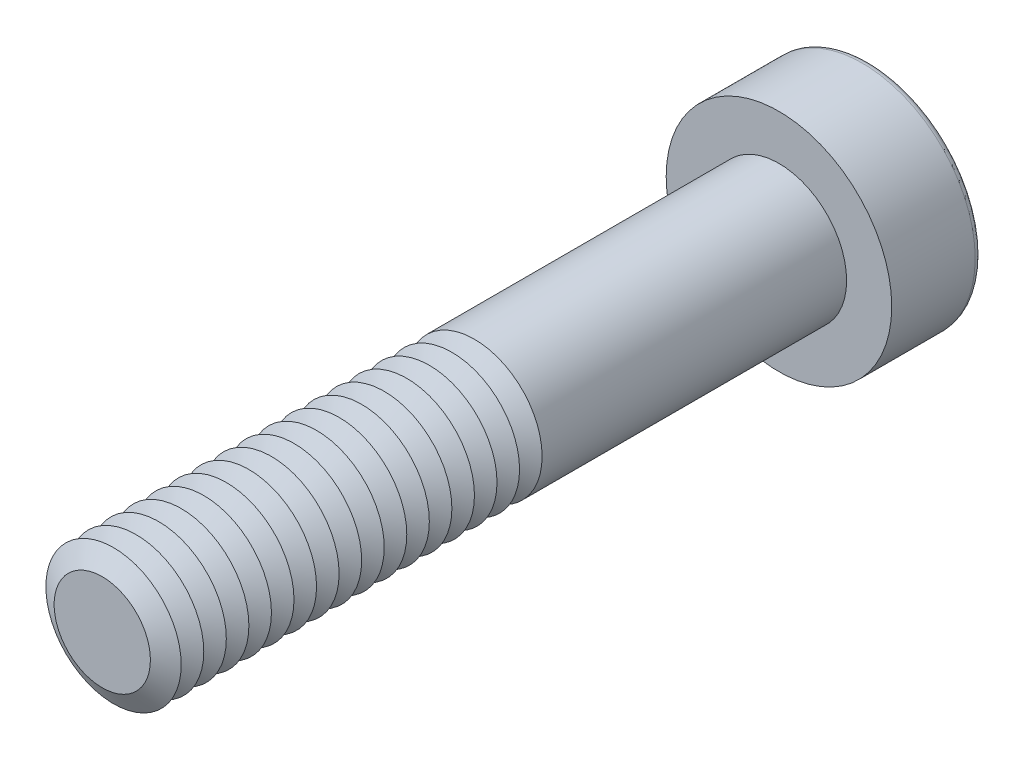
SolidWorks part; units mm, degrees
ref_plane "Front Plane" through (0, 0, 0) normal (0, 0, 1) x (1, 0, 0)
ref_plane "Top Plane" through (0, 0, 0) normal (0, 1, 0) x (1, 0, 0)
ref_plane "Right Plane" through (0, 0, 0) normal (1, 0, 0) x (0, 0, -1)
sketch "Sketch1" plane through (0, 0, 0) normal (0, 0, 1) x (1, 0, 0)
  circle A0 centre (0, 0) radius 3
  dimension "D1" = 6
extrude "Boss-Extrude1" add sketch "Sketch1" along normal blind 30
sketch "Sketch2" plane through (0, 0, 0) normal (0, 0, -1) x (-1, 0, 0)
  circle A0 centre (0, 0) radius 5
  dimension "D1" = 10
extrude "Boss-Extrude2" add sketch "Sketch2" along normal blind 4
sketch "Sketch3" plane through (0, 0, -4) normal (0, 0, -1) x (-1, 0, 0)
  line L1 (-1.1547, 2) -> (-2.3094, 0)
  line L2 (-2.3094, 0) -> (-1.1547, -2)
  line L3 (-1.1547, -2) -> (1.1547, -2)
  line L4 (1.1547, -2) -> (2.3094, 0)
  line L5 (2.3094, 0) -> (1.1547, 2)
  line L6 (1.1547, 2) -> (-1.1547, 2)
  circle A0 centre (0, 0) radius 2 construction
  dimension "D1" = 4
extrude "Cut-Extrude1" cut sketch "Sketch3" against normal blind 3
fillet "Fillet1" radius 0.3 1 edges at (-5, 0, -4)
sketch "Sketch4" plane through (0, 0, -1) normal (0, 0, -1) x (-1, 0, 0)
  line L0 (1.1547, -2) -> (2.3094, 0) construction
  circle A0 centre (0, 0) radius 2
extrude "Cut-Extrude2" cut sketch "Sketch4" against normal through all draft 60
sketch "Sketch5" plane through (0, 0, -4) normal (0, 0, -1) x (-1, 0, 0)
  circle A0 centre (0, 0) radius 2.3094
extrude "Cut-Extrude3" cut sketch "Sketch5" against normal through all draft 75
sketch "Sketch7" plane through (0, 0, 0) normal (1, 0, 0) x (0, 0, -1)
  line L25 (-30, 2.134) -> (-29.5, 3)
  line L26 (-30, 3) -> (-30, -3) construction
  line L27 (-29.5, 3) -> (-30.5, 3)
  line L28 (-30.5, 3) -> (-30, 2.134)
  line L29 (0, 3) -> (-30, 3) construction
  dimension "D1" = 1
revolve "Cut-Revolve1" cut sketch "Sketch7" angle 360 about axis through (0, 0, 30) along (0, 0, -1)
pattern_linear "LPattern1" count 17 spacing 1 along (0, 0, -1) of "Cut-Revolve1"
